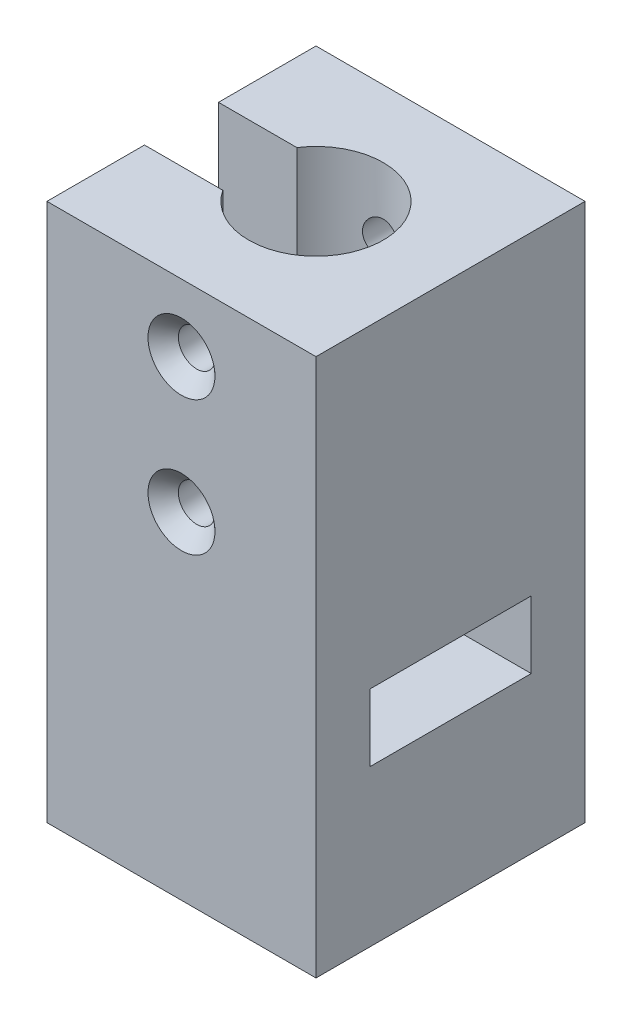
SolidWorks part; units mm, degrees
ref_plane "Front Plane" through (0, 0, 0) normal (0, 0, 1) x (1, 0, 0)
ref_plane "Top Plane" through (0, 0, 0) normal (0, 1, 0) x (1, 0, 0)
ref_plane "Right Plane" through (0, 0, 0) normal (1, 0, 0) x (0, 0, -1)
sketch "Sketch1" plane through (0, 0, 0) normal (0, 1, 0) x (1, 0, 0)
  line L1 (-39.3054, 22.1846) -> (-13.9054, 22.1846)
  line L2 (-39.3054, 22.1846) -> (-39.3054, -3.2154)
  line L3 (-39.3054, -3.2154) -> (-13.9054, -3.2154)
  line L4 (-13.9054, 22.1846) -> (-13.9054, -3.2154)
extrude "Boss-Extrude1" add sketch "Sketch1" along normal blind 50.8
sketch "Sketch2" plane through (0, 50.8, 0) normal (0, 1, 0) x (1, 0, 0)
  line L0 (-39.3054, 22.1846) -> (-39.3054, -3.2154) construction
  line L1 (-13.9054, 22.1846) -> (-39.3054, 22.1846) construction
  circle A0 centre (-26.6054, 9.4846) radius 4.445
  dimension "D1" = 12.7
  dimension "D2" = 12.7
extrude "Cut-Extrude1" cut sketch "Sketch2" against normal blind 44.45 contours A0
sketch "Sketch3" plane through (0, 50.8, 0) normal (0, 1, 0) x (1, 0, 0)
  line L0 (-13.9054, 22.1846) -> (-39.3054, 22.1846) construction
  line L1 (-39.3054, 22.1846) -> (-39.3054, -3.2154) construction
  circle A0 centre (-26.6054, 9.4846) radius 6.35
  dimension "D1" = 12.7
  dimension "D2" = 12.7
extrude "Cut-Extrude2" cut sketch "Sketch3" against normal blind 25.4
sketch "Sketch5" plane through (-39.3054, 0, 0) normal (-1, 0, 0) x (0, 0, 1)
  line L0 (-22.1846, 50.8) -> (3.2154, 50.8) construction
  line L1 (-12.9771, 50.8) -> (-5.9921, 50.8)
  line L2 (-12.9771, 50.8) -> (-12.9771, 15.494)
  line L3 (-12.9771, 15.494) -> (-5.9921, 15.494)
  line L4 (-5.9921, 50.8) -> (-5.9921, 15.494)
  line L5 (-22.1846, 50.8) -> (-22.1846, 0) construction
  dimension "D1" = 6.985
  dimension "D2" = 9.2075
extrude "Cut-Extrude3" cut sketch "Sketch5" against normal blind 12.7
sketch "Sketch6" plane through (-39.3054, 0, 0) normal (-1, 0, 0) x (0, 0, 1)
  line L0 (-22.1846, 50.8) -> (-22.1846, 0) construction
  line L1 (-17.1046, 21.082) -> (-1.8646, 21.082)
  line L2 (-17.1046, 21.082) -> (-17.1046, 14.732)
  line L3 (-17.1046, 14.732) -> (-1.8646, 14.732)
  line L4 (-1.8646, 21.082) -> (-1.8646, 14.732)
  line L5 (-22.1846, 0) -> (3.2154, 0) construction
  dimension "D1" = 5.08
  dimension "D2" = 14.732
  dimension "D3" = 6.35
  dimension "D4" = 15.24
extrude "Cut-Extrude4" cut sketch "Sketch6" against normal blind 25.4
hole_wizard "#8-32 Tapped Hole2" positions "Sketch9" profile "Sketch10" tap size "#8-32" standard "ANSI Inch"
sketch "Sketch9" plane through (0, 0, -22.1846) normal (0, 0, -1) x (-1, 0, 0)
  line L0 (13.9054, 50.8) -> (39.3054, 50.8) construction
  line L1 (13.9054, 50.8) -> (13.9054, 0) construction
  point P0 (26.6054, 44.45)
  point P2 (26.6054, 31.75)
  dimension "D1" = 6.35
  dimension "D2" = 12.7
  dimension "D3" = 12.7
  dimension "D4" = 12.7
sketch "Sketch10" plane through (-26.6054, 44.45, -22.1846) normal (1, 0, 0) x (0, 1, 0)
  line L0 (0, 0) -> (0, 6.35)
  line L1 (0, 6.35) -> (1.7272, 6.35)
  line L2 (1.7272, 6.35) -> (1.7272, 1.4351)
  line L3 (1.7272, 1.4351) -> (3.1623, 0)
  line L5 (3.1623, 0) -> (0, 0)
  line L6 (-1.7272, 1.4351) -> (-3.1623, 0) construction
  line L11 (0, -6.35) -> (0, 107.95) construction
  dimension "Thru Tap Drill Dia." = 3.4544
  dimension "Thru Tap Drill Depth" = 6.35
  dimension "Near C'Sink Dia." = 6.3246
  dimension "Near C'Sink Angle" = 90
hole_wizard "#8-32 Tapped Hole3" positions "Sketch11" profile "Sketch12" tap size "#8-32" standard "ANSI Inch"
sketch "Sketch11" plane through (0, 0, 3.2154) normal (0, 0, 1) x (1, 0, 0)
  line L0 (-39.3054, 50.8) -> (-13.9054, 50.8) construction
  line L1 (-39.3054, 50.8) -> (-39.3054, 0) construction
  point P0 (-26.6054, 44.45)
  point P2 (-26.6054, 31.75)
  dimension "D1" = 12.7
  dimension "D2" = 6.35
  dimension "D3" = 12.7
sketch "Sketch12" plane through (-26.6054, 44.45, 3.2154) normal (1, 0, 0) x (0, -1, 0)
  line L0 (0, 0) -> (0, 6.35)
  line L1 (0, 6.35) -> (1.7272, 6.35)
  line L2 (1.7272, 6.35) -> (1.7272, 1.4351)
  line L3 (1.7272, 1.4351) -> (3.1623, 0)
  line L5 (3.1623, 0) -> (0, 0)
  line L6 (-1.7272, 1.4351) -> (-3.1623, 0) construction
  line L11 (0, -6.35) -> (0, 107.95) construction
  dimension "Thru Tap Drill Dia." = 3.4544
  dimension "Thru Tap Drill Depth" = 6.35
  dimension "Near C'Sink Dia." = 6.3246
  dimension "Near C'Sink Angle" = 90
sketch "Sketch13" plane through (-39.3054, 0, 0) normal (-1, 0, 0) x (0, 0, 1)
  line L0 (-22.1846, 0) -> (3.2154, 0) construction
  line L1 (-13.9296, 7.9502) -> (-5.0396, 7.9502)
  line L2 (-13.9296, 7.9502) -> (-13.9296, 6.35)
  line L3 (-13.9296, 6.35) -> (-5.0396, 6.35)
  line L4 (-5.0396, 7.9502) -> (-5.0396, 6.35)
  line L5 (-22.1846, 50.8) -> (-22.1846, 0) construction
  dimension "D1" = 6.35
  dimension "D2" = 8.89
  dimension "D3" = 1.6002
  dimension "D4" = 8.255
extrude "Cut-Extrude5" cut sketch "Sketch13" against normal blind 12.7
